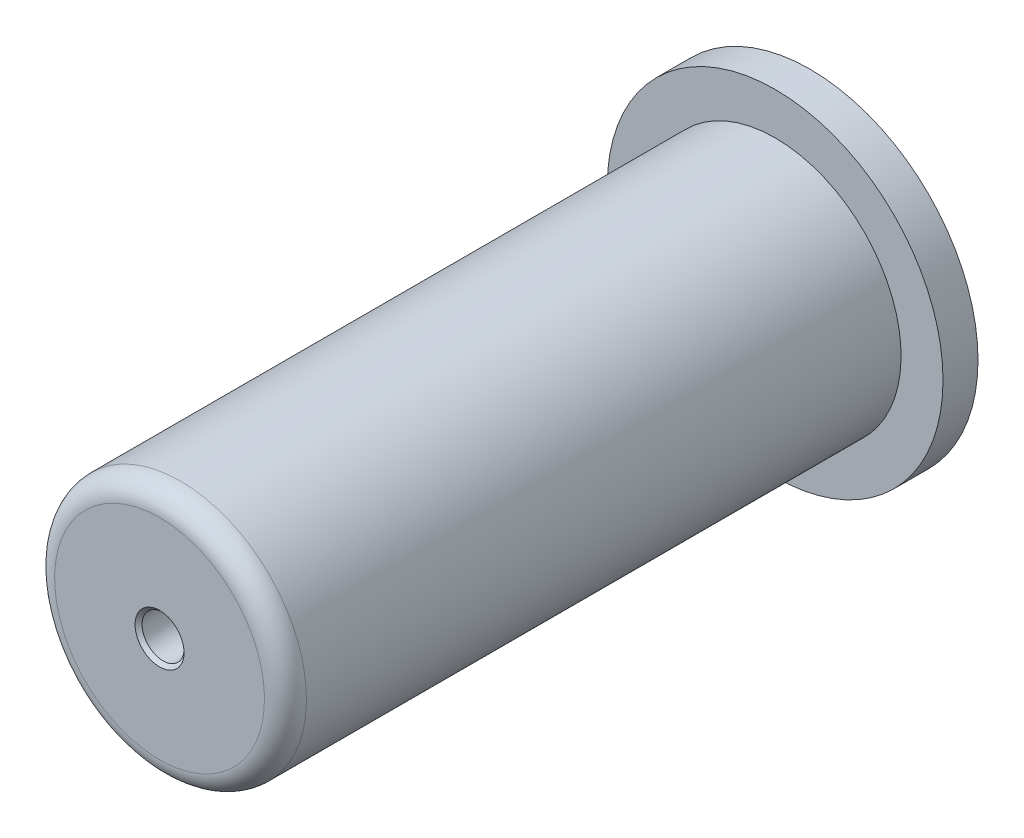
SolidWorks part; units mm, degrees
ref_plane "Front Plane" through (0, 0, 0) normal (0, 0, 1) x (1, 0, 0)
ref_plane "Top Plane" through (0, 0, 0) normal (0, 1, 0) x (1, 0, 0)
ref_plane "Right Plane" through (0, 0, 0) normal (1, 0, 0) x (0, 0, -1)
sketch "Sketch1" plane through (0, 0, 0) normal (1, 0, 0) x (0, 0, -1)
  line L0 (0, 0) -> (-93, 0) construction
  line L1 (0, 0) -> (0, 24)
  line L2 (0, 24) -> (-5, 24)
  line L3 (-5, 24) -> (-5, 18)
  line L4 (-5, 18) -> (-90, 18)
  line L5 (-93, 15) -> (-93, 3.5)
  line L6 (-92.5, 3) -> (-84, 3)
  line L7 (-84, 3) -> (-82.2679, 0)
  line L8 (-92.5, 3) -> (-93, 3.5)
  line L9 (0, 0) -> (-82.2679, 0)
  arc A0 (-90, 18) -> (-93, 15) centre (-90, 15) ccw
  point P9 (-93, 18)
  dimension "D5" = 3
  dimension "D1" = 24
  dimension "D2" = 18
  dimension "D3" = 5
  dimension "D4" = 88
  dimension "D6" = 45
  dimension "D7" = 0.5
  dimension "D8" = 3
  dimension "D9" = 60
  dimension "D10" = 9
revolve "Revolve1" add sketch "Sketch1" angle 360 about L0
